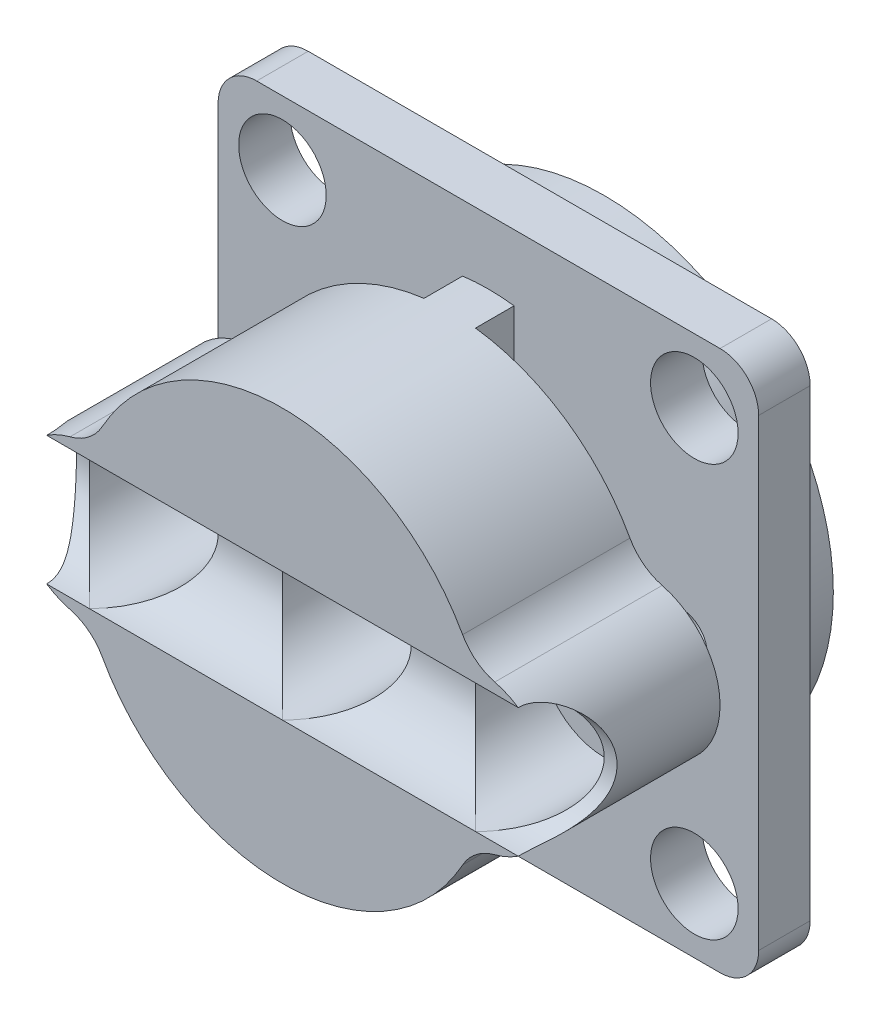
SolidWorks part; units mm, degrees
ref_plane "Plan de face" through (0, 0, 0) normal (0, 0, 1) x (1, 0, 0)
ref_plane "Plan de dessus" through (0, 0, 0) normal (0, 1, 0) x (1, 0, 0)
ref_plane "Plan de droite" through (0, 0, 0) normal (1, 0, 0) x (0, 0, -1)
sketch "Esquisse1" plane through (0, 0, 0) normal (0, 0, 1) x (1, 0, 0)
  line L1 (-21, 21) -> (0, 21)
  line L2 (-21, 21) -> (-21, 0)
  line L3 (-21, 0) -> (0, 0)
  line L4 (0, 21) -> (0, 0)
  dimension "D1" = 21
  dimension "D2" = 21
extrude "Extrusion1" add sketch "Esquisse1" along normal blind 2
sketch "Esquisse2" plane through (0, 0, 2) normal (0, 0, 1) x (1, 0, 0)
  line L0 (-21, 21) -> (-21, 0) construction
  line L1 (0, 21) -> (-21, 21) construction
  circle A0 centre (-10.5, 10.5) radius 8
  point P4 (-10.5, 21)
  dimension "D3" = 16
  dimension "D1" = 10.5
  dimension "D2" = 10.5
extrude "Extrusion2" add sketch "Esquisse2" along normal blind 8
ref_plane "Plan1" through (0, 10.5, 0) normal (0, 1, 0) x (-1, 0, 0)
hole_wizard "Dégagement M31" positions "Esquisse6" profile "Esquisse5" hole size "M3" standard "ISO"
sketch "Esquisse6" plane through (0, 0, 2) normal (0, 0, 1) x (1, 0, 0)
  line L0 (0, 0) -> (0, 21) construction
  line L1 (0, 21) -> (-21, 21) construction
  point P0 (-2.5, 18.5)
  dimension "D1" = 2.5
  dimension "D2" = 2.5
sketch "Esquisse5" plane through (-2.5, 18.5, 2) normal (1, 0, 0) x (0, -1, 0)
  line L0 (0, 0) -> (0, 2)
  line L1 (0, 2) -> (1.7, 2)
  line L2 (1.7, 2) -> (1.7, 0)
  line L5 (1.7, 0) -> (0, 0)
  line L11 (0, -6.35) -> (0, 107.95) construction
  dimension "Diamètre du perçage jusqu'au prochain" = 3.4
  dimension "Profondeur du perçage jusqu'au prochain" = 2
pattern_linear "Répétition linéaire1" count 2 spacing 16 along (0, -1, 0) count 2 spacing 16 along (-1, 0, 0) of "Dégagement M31"
fillet "Congé1" radius 1.5 4 edges at (-21, 21, 1) (0, 21, 1) (0, 0, 1) (-21, 0, 1)
sketch "Esquisse7" plane through (0, 0, 0) normal (0, 0, -1) x (-1, 0, 0)
  line L0 (0, 1.5) -> (0, 19.5) construction
  line L1 (1.5, 21) -> (19.5, 21) construction
  circle A0 centre (10.5, 10.5) radius 8.9
  dimension "D3" = 17.8
  dimension "D1" = 10.5
  dimension "D2" = 10.5
extrude "Extrusion4" add sketch "Esquisse7" along normal blind 2.5
sketch "Esquisse8" plane through (0, 0, -2.5) normal (0, 0, -1) x (-1, 0, 0)
  circle A0 centre (10.5, 10.5) radius 4.5308
  circle A1 centre (10.5, 10.5) radius 8.9 construction
extrude "Enlèv. mat.-Extru.2" cut sketch "Esquisse8" against normal blind 2.5
sketch "Esquisse9" plane through (0, 0, 0) normal (0, 0, -1) x (-1, 0, 0)
  circle A0 centre (10.5, 10.5) radius 2.5
  circle A1 centre (10.5, 10.5) radius 4.5308 construction
  dimension "D1" = 5
extrude "Enlèv. mat.-Extru.6" cut sketch "Esquisse9" against normal up to next
sketch "Esquisse10" plane through (0, 0, 2) normal (0, 0, 1) x (1, 0, 0)
  line L0 (-1.5, 21) -> (-19.5, 21) construction
  line L2 (-21, 19.5) -> (-21, 1.5) construction
  circle A0 centre (-18, 10.5) radius 3
  circle A1 centre (-3, 10.5) radius 3
  dimension "D1" = 6
  dimension "D2" = 6
  dimension "D4" = 3
  dimension "D5" = 10.5
  dimension "D3" = 10.5
  dimension "D6" = 15
extrude "Extrusion5" add sketch "Esquisse10" along normal blind 8
fillet "Congé2" radius 2 4 edges at (-17.9167, 13.4988, 6) (-17.9167, 7.5012, 6) (-3.0833, 7.5012, 6) (-3.0833, 13.4988, 6)
sketch "Esquisse11" plane through (0, 21, 0) normal (0, 1, 0) x (-1, 0, 0)
  line L0 (21, 2) -> (21, 10) construction
  line L1 (0, 2) -> (9.5, 2)
  line L2 (0, 2) -> (0, 3.5)
  line L3 (0, 3.5) -> (9.5, 3.5)
  line L4 (9.5, 2) -> (9.5, 3.5)
  line L5 (11.5, 2) -> (21, 2)
  line L6 (11.5, 2) -> (11.5, 3.5)
  line L7 (11.5, 3.5) -> (21, 3.5)
  line L8 (21, 2) -> (21, 3.5)
  dimension "D1" = 9.5
  dimension "D2" = 1.5
  dimension "D3" = 1.5
  dimension "D4" = 2
extrude "Enlèv. mat.-Extru.7" cut sketch "Esquisse11" against normal through all
hole_wizard "Chambrage pour vis à tête ronde bombée M22" positions "Esquisse18" profile "Esquisse17" counterbore size "M2" standard "Ansi Métrique"
sketch "Esquisse18" plane through (0, 0, 10) normal (0, 0, 1) x (1, 0, 0)
  arc A0 (-18.75, 13.4047) -> (-18.75, 7.5953) centre (-18, 10.5) ccw construction
  point P0 (-18, 10.5)
sketch "Esquisse17" plane through (-18, 10.5, 10) normal (1, 0, 0) x (0, -1, 0)
  line L0 (0, 0) -> (0, 6.5)
  line L1 (0, 6.5) -> (1.1, 6.5)
  line L3 (1.1, 6.5) -> (1.1, 5)
  line L4 (1.1, 5) -> (2.5, 5)
  line L5 (2.5, 5) -> (2.5, 0)
  line L7 (2.5, 0) -> (0, 0)
  line L11 (0, -6.35) -> (0, 107.95) construction
  dimension "Diamètre du perçage jusqu'au prochain" = 2.2
  dimension "Profondeur du perçage jusqu'au prochain" = 6.5
  dimension "Diamètre du chambrage" = 5
  dimension "Profondeur du chambrage" = 5
sketch "Esquisse20" plane through (-21, 0, 0) normal (-1, 0, 0) x (0, 0, 1)
  line L0 (10, 7.5953) -> (10, 13.4047) construction
  line L1 (0, 0) -> (2, 0) construction
  circle A0 centre (10, 10.5) radius 2.5
  dimension "D1" = 10.5
extrude "Enlèv. mat.-Extru.9" cut sketch "Esquisse20" against normal through all
hole_wizard "Chambrage pour vis à tête ronde bombée M23" positions "Esquisse23" profile "Esquisse22" counterbore size "M2" standard "Ansi Métrique"
sketch "Esquisse23" plane through (0, 0, 10) normal (0, 0, 1) x (1, 0, 0)
  arc A0 (-1.3417, 8) -> (-1.3417, 13) centre (-3, 10.5) ccw construction
  point P0 (-3, 10.5)
sketch "Esquisse22" plane through (-3, 10.5, 10) normal (1, 0, 0) x (0, -1, 0)
  line L0 (0, 0) -> (0, 6.5)
  line L1 (0, 6.5) -> (1.1, 6.5)
  line L3 (1.1, 6.5) -> (1.1, 5)
  line L4 (1.1, 5) -> (2.5, 5)
  line L5 (2.5, 5) -> (2.5, 0)
  line L7 (2.5, 0) -> (0, 0)
  line L11 (0, -6.35) -> (0, 107.95) construction
  dimension "Diamètre du perçage jusqu'au prochain" = 2.2
  dimension "Profondeur du perçage jusqu'au prochain" = 6.5
  dimension "Diamètre du chambrage" = 5
  dimension "Profondeur du chambrage" = 5
hole_wizard "Trou taraudé M2x0.42" positions "Esquisse29" profile "Esquisse28" tap size "M2x0.4" standard "Ansi Métrique"
sketch "Esquisse29" plane through (0, 0, 2) normal (0, 0, 1) x (1, 0, 0)
  circle A0 centre (-18, 10.5) radius 1.1 construction
  point P0 (-18, 10.5)
sketch "Esquisse28" plane through (-18, 10.5, 2) normal (1, 0, 0) x (0, -1, 0)
  line L0 (0, 0) -> (0, 4.5)
  line L1 (0, 4.5) -> (1, 4.5)
  line L2 (1, 4.5) -> (1, 0)
  line L5 (1, 0) -> (0, 0)
  line L11 (0, -6.35) -> (0, 107.95) construction
  dimension "Diamètre principal du filetage" = 2
  dimension "Profondeur du trou pour taraudage jusqu'au prochain" = 4.5
hole_wizard "Trou taraudé M2x0.43" positions "Esquisse31" profile "Esquisse30" tap size "M2x0.4" standard "Ansi Métrique"
sketch "Esquisse31" plane through (0, 0, 2) normal (0, 0, 1) x (1, 0, 0)
  circle A0 centre (-3, 10.5) radius 1.1 construction
  point P0 (-3, 10.5)
sketch "Esquisse30" plane through (-3, 10.5, 2) normal (1, 0, 0) x (0, -1, 0)
  line L0 (0, 0) -> (0, 4.5)
  line L1 (0, 4.5) -> (1, 4.5)
  line L2 (1, 4.5) -> (1, 0)
  line L5 (1, 0) -> (0, 0)
  line L11 (0, -6.35) -> (0, 107.95) construction
  dimension "Diamètre principal du filetage" = 2
  dimension "Profondeur du trou pour taraudage jusqu'au prochain" = 4.5
